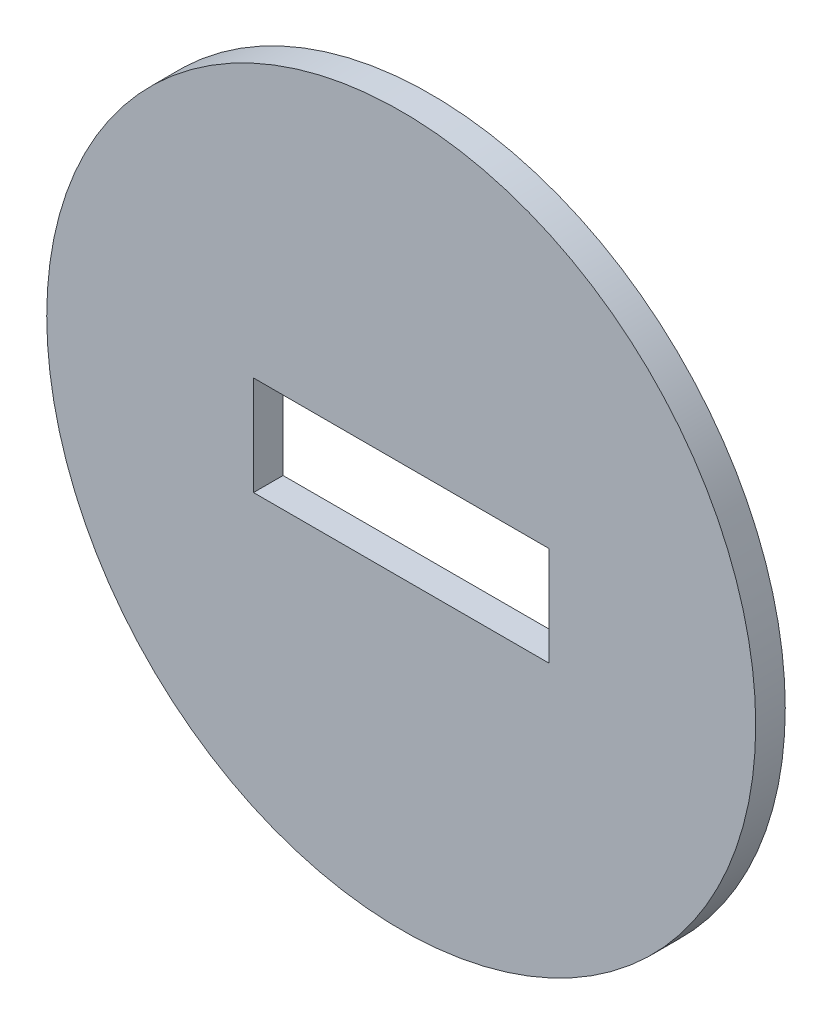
SolidWorks part; units mm, degrees
ref_plane "Front Plane" through (0, 0, 0) normal (0, 0, 1) x (1, 0, 0)
ref_plane "Top Plane" through (0, 0, 0) normal (0, 1, 0) x (1, 0, 0)
ref_plane "Right Plane" through (0, 0, 0) normal (1, 0, 0) x (0, 0, -1)
sketch "Sketch1" plane through (0, 0, 0) normal (0, 0, 1) x (1, 0, 0)
  circle A0 centre (0, 0) radius 38.1
  dimension "D1" = 76.2
extrude "Extrude1" add sketch "Sketch1" along normal blind 3.175
sketch "Sketch2" plane through (0, 0, 3.175) normal (0, 0, 1) x (1, 0, 0)
  line L1 (-15.875, 5.334) -> (15.875, 5.334)
  line L2 (-15.875, 5.334) -> (-15.875, -5.334)
  line L3 (-15.875, -5.334) -> (15.875, -5.334)
  line L4 (15.875, 5.334) -> (15.875, -5.334)
  dimension "D1" = 31.75
  dimension "D2" = 10.668
  dimension "D3" = 5.334
  dimension "D4" = 15.875
extrude "Cut-Extrude1" cut sketch "Sketch2" against normal through all
